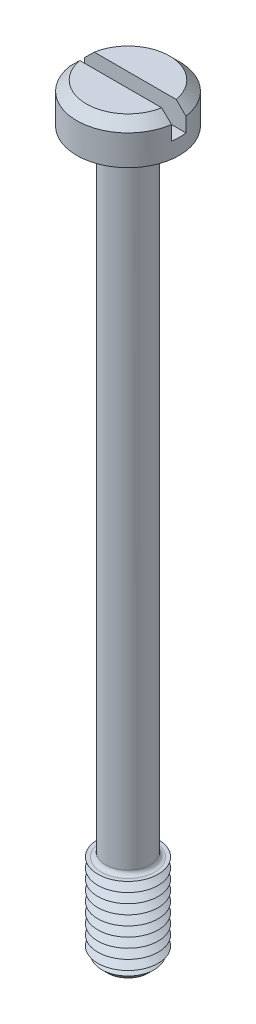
SolidWorks part; units mm, degrees
ref_plane "Front Plane" through (0, 0, 0) normal (0, 0, 1) x (1, 0, 0)
ref_plane "Top Plane" through (0, 0, 0) normal (0, 1, 0) x (1, 0, 0)
ref_plane "Right Plane" through (0, 0, 0) normal (1, 0, 0) x (0, 0, -1)
sketch "Sketch1" plane through (0, 0, 0) normal (0, 1, 0) x (1, 0, 0)
  circle A0 centre (0, 0) radius 4.25
  dimension "D1" = 8.5
extrude "Boss-Extrude1" add sketch "Sketch1" along normal blind 3.3
sketch "Sketch2" plane through (0, 0, 0) normal (0, -1, 0) x (1, 0, 0)
  circle A0 centre (0, 0) radius 1.85
  dimension "D1" = 3.7
extrude "Boss-Extrude2" add sketch "Sketch2" along normal blind 60
sketch "Sketch3" plane through (0, -60, 0) normal (0, -1, 0) x (1, 0, 0)
  circle A0 centre (0, 0) radius 2.5
  dimension "D1" = 5
extrude "Boss-Extrude3" add sketch "Sketch3" against normal blind 7.5
chamfer "Chamfer1" distance 0.8 angle 45 1 edges at (0, -60, -2.5)
sketch "Sketch4" plane through (0, 0, 0) normal (1, 0, 0) x (0, 0, -1)
  line L0 (0, -6.5871) -> (0, -12.0372) construction
sketch "Sketch5" plane through (0, 0, 0) normal (1, 0, 0) x (0, 0, -1)
  line L0 (-2.5, -52.5) -> (-1.8072, -52.9)
  line L1 (-1.8072, -52.9) -> (-2.5, -53.3)
  line L2 (-2.5, -52.5) -> (-2.5, -59.2) construction
  line L3 (-2.5, -53.3) -> (-2.5, -52.5)
  dimension "D1" = 0.8
revolve "Cut-Revolve1" cut sketch "Sketch5" angle 360 about L0
pattern_linear "LPattern1" count 9 spacing 0.8 along (0, -1, 0) of "Cut-Revolve1"
fillet "Fillet1" radius 0.35 2 edges at (0, -52.5, -1.85) (0, 0, -1.85)
chamfer "Chamfer2" distance 0.8 angle 45 1 edges at (0, 3.3, 4.25)
sketch "Sketch6" plane through (0, 3.3, 0) normal (0, 1, 0) x (1, 0, 0)
  line L1 (4.25, -0.6) -> (-4.25, -0.6)
  line L2 (4.25, -0.6) -> (4.25, 0.6)
  line L3 (4.25, 0.6) -> (-4.25, 0.6)
  line L4 (-4.25, -0.6) -> (-4.25, 0.6)
  line L5 (4.25, -0.6) -> (-4.25, 0.6) construction
  line L6 (4.25, 0.6) -> (-4.25, -0.6) construction
  circle A0 centre (0, 0) radius 4.25 construction
  point P0 (0, 0)
  dimension "D1" = 1.2
extrude "Cut-Extrude1" cut sketch "Sketch6" against normal blind 2
